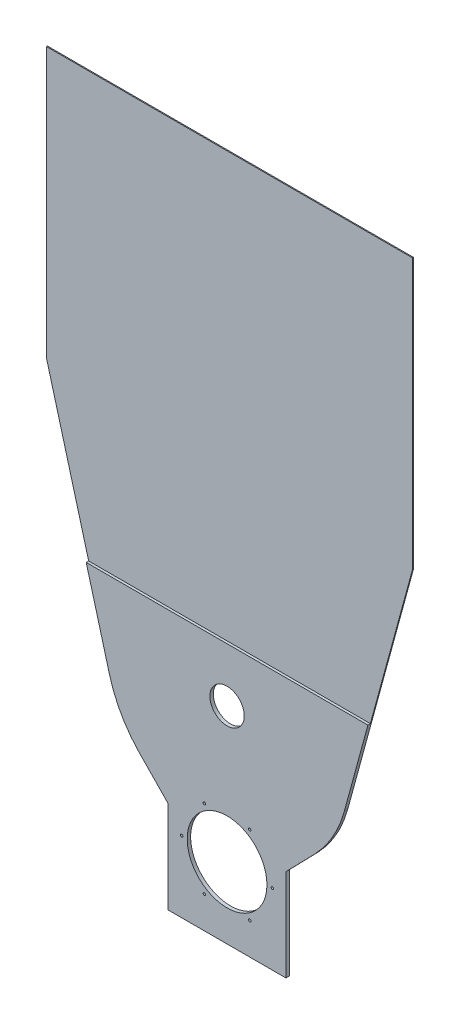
SolidWorks part; units mm, degrees
ref_plane "Front Plane" through (0, 0, 0) normal (0, 0, 1) x (1, 0, 0)
ref_plane "Top Plane" through (0, 0, 0) normal (0, 1, 0) x (1, 0, 0)
ref_plane "Right Plane" through (0, 0, 0) normal (1, 0, 0) x (0, 0, -1)
sketch "Sketch1" plane through (0, 0, 0) normal (0, 0, 1) x (1, 0, 0)
  line L0 (574, 770) -> (-574, 770) construction
  line L1 (0, 0) -> (0, 770) construction
  line L2 (-240, 85.4146) -> (-359.3783, 208.1473)
  line L3 (-746, 1400) -> (-478.5146, 419.4636)
  line L4 (-162.5, 0) -> (-156.9199, 0) construction
  line L5 (746, 1400) -> (478.5146, 419.4636)
  line L6 (0, 0) -> (0, -290) construction
  line L7 (-240, -290) -> (240, -290)
  line L8 (240, -290) -> (240, 85.4146)
  line L9 (-240, -290) -> (-240, 85.4146)
  line L10 (478.5146, 419.4636) -> (-478.5146, 419.4636) construction
  line L11 (240, 85.4146) -> (359.3783, 208.1473)
  line L13 (-240, 85.4146) -> (-156.9199, 0) construction
  line L14 (0, 770) -> (0, 2500) construction
  line L15 (-746, 1400) -> (-746, 2500)
  line L16 (-746, 2500) -> (746, 2500)
  line L17 (746, 2500) -> (746, 1400)
  line L18 (-162.5, 0) -> (-159.6327, 2.789) construction
  circle A0 centre (0, 0) radius 162.5
  arc A1 (-478.5146, 419.4636) -> (-359.3783, 208.1473) centre (0, 550) ccw
  arc A2 (478.5146, 419.4636) -> (359.3783, 208.1473) centre (0, 550) cw
  circle A3 centre (0, 550) radius 70
  dimension "D1" = 325
  dimension "D2" = 220
  dimension "D3" = 496
  dimension "D6" = 4
  dimension "D9" = 140
  dimension "D10" = 1492
  dimension "D4" = 550
  dimension "D5" = 1148
  dimension "D7" = 480
  dimension "D8" = 290
  dimension "D11" = 1100
  dimension "D12" = 1400
  dimension "D13" = 171.2147
extrude "Boss-Extrude1" add sketch "Sketch1" along normal blind 14
hole_wizard "M12 Tapped Hole1" positions "Sketch3" profile "Sketch4" tap size "M12" standard "DIN"
sketch "Sketch3" plane through (0, 0, 0) normal (0, 0, -1) x (-1, 0, 0)
  line L0 (0, 0) -> (185, 0) construction
  point P0 (185, 0)
  dimension "D1" = 185
sketch "Sketch4" plane through (-185, 0, 0) normal (1, 0, 0) x (0, 1, 0)
  line L0 (0, 0) -> (0, 14)
  line L1 (0, 14) -> (5.1, 14)
  line L2 (5.1, 14) -> (5.1, 0)
  line L5 (5.1, 0) -> (0, 0)
  line L11 (0, -6.35) -> (0, 107.95) construction
  dimension "Thru Tap Drill Dia." = 10.2
  dimension "Thru Tap Drill Depth" = 14
pattern_circular "CirPattern1" count 6 over 360 about axis through (0, 0, 0) along (0, 0, 1) of "M12 Tapped Hole1"
sketch "Sketch5" plane through (0, 0, 14) normal (0, 0, -1) x (-1, 0, 0)
  line L0 (-746, 2500) -> (746, 2500)
  line L1 (746, 2500) -> (746, 1400)
  line L2 (746, 1400) -> (574.1392, 770)
  line L4 (-478.5146, 419.4636) -> (-746, 1400) construction
  line L6 (-574.1392, 770) -> (-746, 1400)
  line L7 (-746, 1400) -> (-746, 2500)
  line L8 (746, 1400) -> (478.5146, 419.4636) construction
  line L9 (-574.1392, 770) -> (574.1392, 770)
  line L10 (-574, 770) -> (574, 770) construction
extrude "Cut-Extrude1" cut sketch "Sketch5" along normal blind 10
